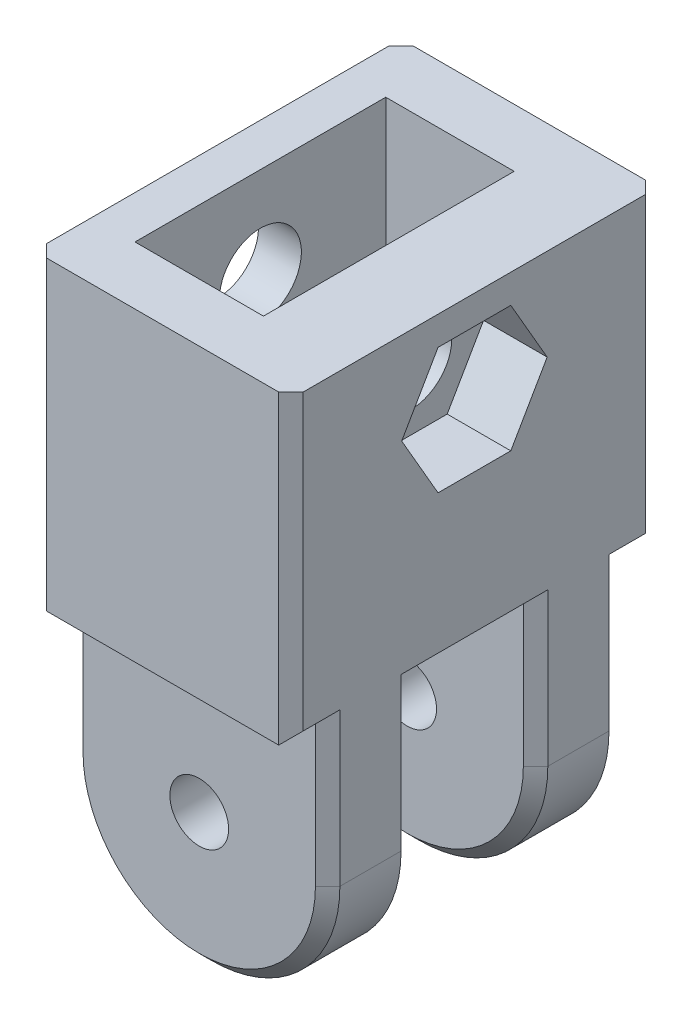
SolidWorks part; units mm, degrees
ref_plane "Front Plane" through (0, 0, 0) normal (0, 0, 1) x (1, 0, 0)
ref_plane "Top Plane" through (0, 0, 0) normal (0, 1, 0) x (1, 0, 0)
ref_plane "Right Plane" through (0, 0, 0) normal (1, 0, 0) x (0, 0, -1)
sketch "Sketch2" plane through (0, 0, 0) normal (0, 0, 1) x (1, 0, 0)
  line L1 (-21, 25) -> (0, 25)
  line L2 (-21, 25) -> (-21, 0)
  line L3 (-21, 0) -> (0, 0)
  line L4 (0, 25) -> (0, 0)
  dimension "D1" = 25
  dimension "D2" = 21
extrude "Boss-Extrude1" add sketch "Sketch2" along normal mid plane 30
sketch "Sketch3" plane through (0, 25, 0) normal (0, 1, 0) x (1, 0, 0)
  line L1 (-17.5, 10.25) -> (-7, 10.25)
  line L2 (-17.5, 10.25) -> (-17.5, -10.25)
  line L3 (-17.5, -10.25) -> (-7, -10.25)
  line L4 (-7, 10.25) -> (-7, -10.25)
  point P4 (-7, 0)
  dimension "D1" = 10.5
  dimension "D2" = 20.5
  dimension "D3" = 7
extrude "Cut-Extrude1" cut sketch "Sketch3" against normal blind 18.5
sketch "Sketch4" plane through (-21, 0, 0) normal (-1, 0, 0) x (0, 0, 1)
  line L0 (15, 25) -> (-15, 25) construction
  circle A0 centre (0, 17.5) radius 3.35
  point P5 (0, 25)
  dimension "D2" = 6.7
  dimension "D1" = 7.5
extrude "Cut-Extrude2" cut sketch "Sketch4" against normal through all both and the other way through all
sketch "Sketch5" plane through (0, 0, 0) normal (1, 0, 0) x (0, 0, -1)
  line L1 (2.9734, 22.65) -> (-2.9734, 22.65)
  line L2 (-2.9734, 22.65) -> (-5.9467, 17.5)
  line L3 (-5.9467, 17.5) -> (-2.9734, 12.35)
  line L4 (-2.9734, 12.35) -> (2.9734, 12.35)
  line L5 (2.9734, 12.35) -> (5.9467, 17.5)
  line L6 (5.9467, 17.5) -> (2.9734, 22.65)
  circle A0 centre (0, 17.5) radius 5.15 construction
  dimension "D1" = 10.3
extrude "Cut-Extrude3" cut sketch "Sketch5" against normal blind 5.2
sketch "Sketch6" plane through (0, 0, 0) normal (0, -1, 0) x (1, 0, 0)
  line L0 (0, 15) -> (0, -15) construction
  line L1 (-21, 12) -> (0, 12)
  line L2 (-21, 12) -> (-21, 5)
  line L3 (-21, 5) -> (0, 5)
  line L4 (0, 12) -> (0, 5)
  line L5 (11.55, 0) -> (-11.55, 0) construction
  line L6 (-21, -5) -> (0, -5)
  line L7 (0, -12) -> (0, -5)
  line L8 (-21, -12) -> (0, -12)
  line L9 (-21, -12) -> (-21, -5)
  line L10 (-21, 15) -> (-21, -15) construction
  dimension "D1" = 10
  dimension "D2" = 7
extrude "Boss-Extrude2" add sketch "Sketch6" along normal blind 22
sketch "Sketch7" plane through (0, 0, -5) normal (0, 0, 1) x (1, 0, 0)
  line L0 (0, -22) -> (0, 0) construction
  line L1 (0, 0) -> (-21, 0) construction
  circle A0 centre (-10.5, -11) radius 2.4
  point P5 (0, -11)
  point P8 (-10.5, 0)
  dimension "D1" = 4.8
extrude "Cut-Extrude4" cut sketch "Sketch7" against normal through all both and the other way through all
fillet "Fillet2" radius 10.5 4 edges at (-21, -22, -8.5) (0, -22, -8.5) (-21, -22, 8.5) (0, -22, 8.5)
chamfer "Chamfer2" distance 1 angle 45 26 edges at (-21, 0, 0) (-21, 0, -13.5) (-21, 12.5, -15) (-21, 0, 13.5) (-21, 12.5, 15) (-21, -5.75, -5) (-21, -5.75, 5) (-17.9246, -18.9246, -5) (-17.9246, -18.9246, 5) (-3.0754, -18.9246, -5) (-3.0754, -18.9246, 5) (0, -5.75, -5) (0, 0, 0) (0, -5.75, 5) (-21, -5.75, -12) (-17.9246, -18.9246, -12) (-3.0754, -18.9246, -12) (0, -5.75, -12) (0, 0, -13.5) (0, 12.5, -15) (-21, -5.75, 12) (-17.9246, -18.9246, 12) (-3.0754, -18.9246, 12) (0, -5.75, 12) (0, 0, 13.5) (0, 12.5, 15)
